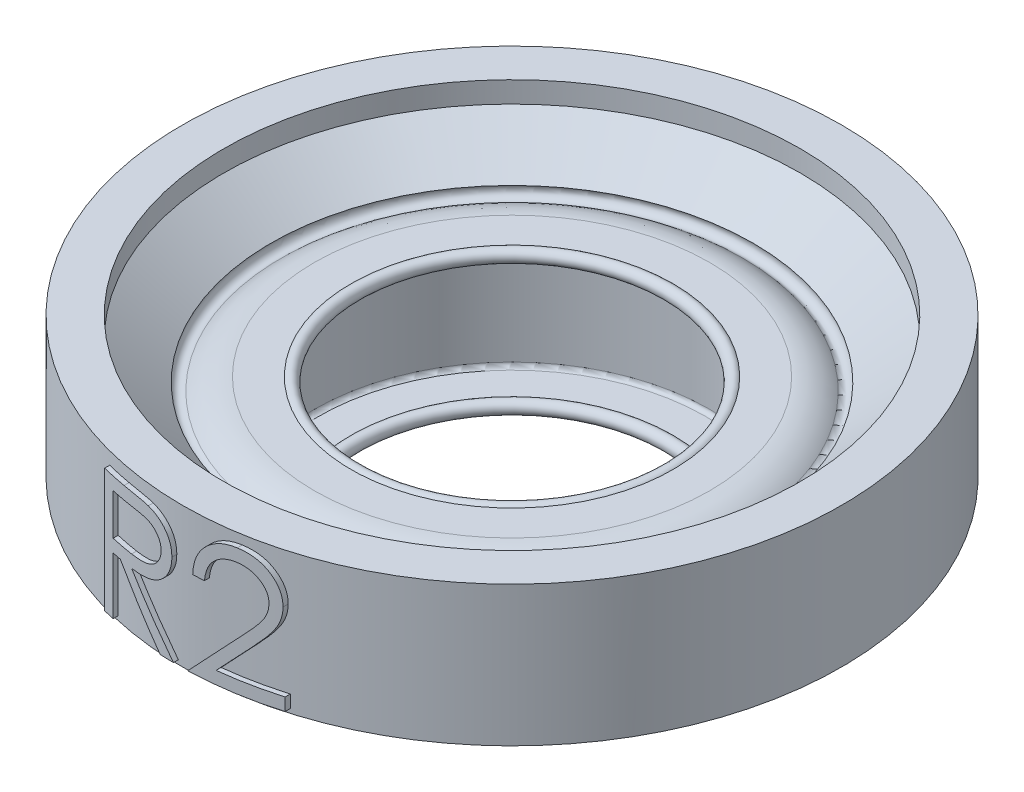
SolidWorks part; units mm, degrees
ref_plane "Front Plane" through (0, 0, 0) normal (0, 0, 1) x (1, 0, 0)
ref_plane "Top Plane" through (0, 0, 0) normal (0, 1, 0) x (1, 0, 0)
ref_plane "Right Plane" through (0, 0, 0) normal (1, 0, 0) x (0, 0, -1)
sketch "Sketch1" plane through (0, 0, 0) normal (0, 1, 0) x (1, 0, 0)
  circle A0 centre (0, 0) radius 44.45
  dimension "D1" = 88.9
extrude "Boss-Extrude1" add sketch "Sketch1" along normal blind 9.3396
sketch "Sketch2" plane through (0, 0, 0) normal (0, 0, 1) x (1, 0, 0)
  line L0 (-35.8554, 9.3396) -> (-31.9022, 11.9165)
  line L2 (-31.9022, 11.9165) -> (-21.9493, 11.9165)
  line L3 (-21.9493, 11.9165) -> (-21.9493, 9.3396)
  line L5 (-21.9493, 9.3396) -> (-35.8554, 9.3396)
  line L6 (0, 0) -> (0, 22.2148) construction
  line L7 (44.45, 9.3396) -> (-44.45, 9.3396) construction
revolve "Revolve2" add sketch "Sketch2" angle 360 about L6
sketch "Sketch3" plane through (0, 9.3396, 0) normal (0, 1, 0) x (1, 0, 0)
  circle A4 centre (0, 0) radius 21.9493 construction
  circle A5 centre (0, 0) radius 21.9493
extrude "Cut-Extrude1" cut sketch "Sketch3" against normal through all
sketch "Sketch4" plane through (0, 0, 0) normal (0, 0, 1) x (1, 0, 0)
  line L0 (36.185, 9.3396) -> (44.45, 15.7969)
  line L1 (44.45, 9.3396) -> (-44.45, 9.3396) construction
  line L3 (44.45, 15.7969) -> (44.45, 9.3396)
  line L4 (44.45, 9.3396) -> (36.185, 9.3396)
  line L5 (0, 0) -> (0, 31.4198) construction
  dimension "D1" = 38
  dimension "D2" = 8.265
revolve "Revolve3" add sketch "Sketch4" angle 360 about L5
sketch "Sketch5" plane through (0, 0, 0) normal (0, 1, 0) x (1, 0, 0)
  circle A0 centre (0, 0) radius 50.8
  circle A1 centre (0, 0) radius 44.45
  circle A2 centre (0, 0) radius 44.45 construction
  dimension "D1" = 101.6
extrude "Boss-Extrude2" add sketch "Sketch5" along normal blind 19.05
sketch "Sketch7" plane through (0, 0, 0) normal (0, 0, 1) x (1, 0, 0)
  line L0 (20.5463, 0) -> (20.5463, -12.7)
  line L1 (-50.8, 0) -> (50.8, 0) construction
  line L2 (20.5463, -12.7) -> (31.2749, -12.7)
  line L3 (31.2749, -12.7) -> (50.8, 0)
  line L4 (20.5463, 0) -> (50.8, 0)
  line L5 (0, 0) -> (0, -21.6393) construction
  dimension "D1" = 41.0926
  dimension "D2" = 12.7
  dimension "D3" = 62.5498
revolve "Revolve4" add sketch "Sketch7" angle 360 about L5
other "Cavity2"
other "Rubber Port Tube<1>@Small port mold2"
ref_plane "Plane1" through (0, 0, 0) normal (0, -1, 0) x (-1, 0, 0)
sketch "Sketch9" plane through (0, 0, 0) normal (0, -1, 0) x (-1, 0, 0)
  circle A0 centre (0, 0) radius 50.8
  circle A1 centre (0, 0) radius 41.91
  dimension "D1" = 83.82
extrude "Boss-Extrude3" add sketch "Sketch9" along normal blind 2.54
ref_plane "Plane2" through (0, 0, 58.42) normal (0, 0, 1) x (1, 0, 0)
sketch "Sketch10" plane through (0, 0, 58.42) normal (0, 0, 1) x (1, 0, 0)
  text T0 "R2" font "Century Gothic" height in points 72
extrude "Boss-Extrude4" add sketch "Sketch10" against normal up to body separate body
sketch "Sketch11" plane through (0, 0, 0) normal (0, -1, 0) x (-1, 0, 0)
  circle A0 centre (0, 0) radius 51.562
  circle A1 centre (0, 0) radius 50.8 construction
  dimension "D1" = 0.762
extrude "Cut-Extrude2" cut sketch "Sketch11" against normal through all and the other way through all flip side to cut
